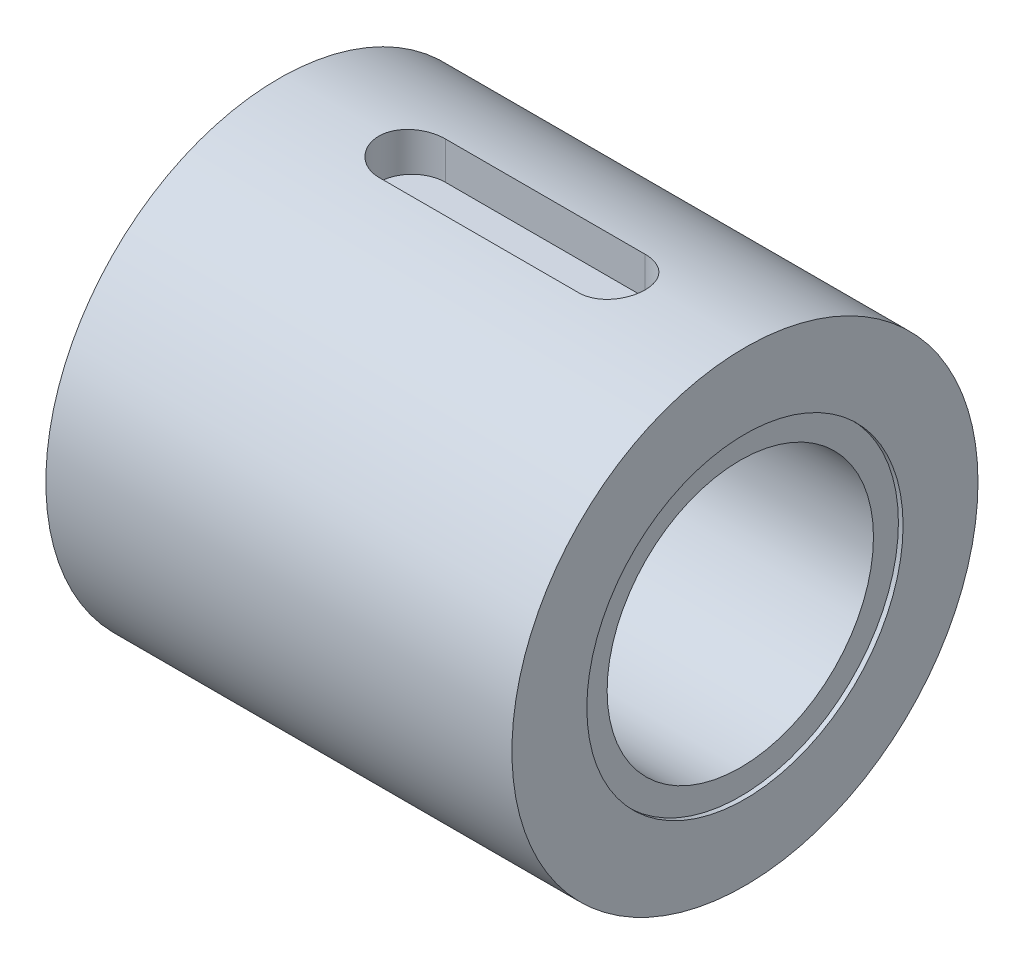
SolidWorks part; units mm, degrees
ref_plane "Front" through (0, 0, 0) normal (0, 0, 1) x (1, 0, 0)
ref_plane "Top" through (0, 0, 0) normal (0, 1, 0) x (1, 0, 0)
ref_plane "Right" through (0, 0, 0) normal (1, 0, 0) x (0, 0, -1)
sketch "Sketch1" plane through (0, 0, 0) normal (1, 0, 0) x (0, 0, -1)
  circle A0 centre (0, 0) radius 7
  circle A1 centre (0, 0) radius 4
extrude "Extrude1" add sketch "Sketch1" along normal blind 14
sketch "Sketch2" plane through (14, 0, 0) normal (1, 0, 0) x (0, 0, -1)
  circle A0 centre (0, 0) radius 4
  circle A1 centre (0, 0) radius 4.7495
extrude "Cut-Extrude1" cut sketch "Sketch2" against normal blind 0.14
sketch "Sketch3" plane through (0, 0, 0) normal (-1, 0, 0) x (0, 0, 1)
  circle A1 centre (0, 0) radius 4.7495
  circle A2 centre (0, 0) radius 4.7495
  circle A3 centre (0, 0) radius 4
  circle A4 centre (0, 0) radius 4
  dimension "D1" = 0
  dimension "D2" = 0
extrude "Cut-Extrude2" cut sketch "Sketch3" against normal blind 0.14
ref_plane "Plane1" through (0, 7, 0) normal (0, 1, 0) x (-1, 0, 0)
sketch "Sketch4" plane through (0, 7, 0) normal (0, 1, 0) x (-1, 0, 0)
  line L0 (0, 0) -> (-14, 0) construction
  line L2 (-10, -1) -> (-4, -1)
  line L3 (-4, 1) -> (-10, 1)
  line L4 (-7, 1) -> (-7, -1) construction
  arc A0 (-4, -1) -> (-4, 1) centre (-4, 0) ccw
  arc A1 (-10, 1) -> (-10, -1) centre (-10, 0) ccw
  point P2 (0, 0)
  point P13 (-7, 0)
extrude "Cut-Extrude3" cut sketch "Sketch4" against normal blind 1.2
sketch "Sketch5" plane through (0, 0, 0) normal (0, 1, 0) x (1, 0, 0)
  line L0 (0, 0) -> (14, 0) construction
  line L1 (14, -7) -> (14, 7) construction
  circle A0 centre (12.5, 0) radius 0.75
extrude "Cut-Extrude4" [suppressed] cut sketch "Sketch5" along normal through all
sketch "Sketch6" plane through (0, 0, 0) normal (0, 0, 1) x (1, 0, 0)
  line L0 (0, 0) -> (5.6719, 0) construction
  line L1 (0, 8.1) -> (0.9, 9)
  line L2 (0, 7) -> (0, -7) construction
  line L3 (0.9, 9) -> (6.3, 9)
  line L4 (6.3, 9) -> (7.2, 8.1)
  line L5 (7.2, 8.1) -> (9, 8.1)
  line L6 (9, 8.1) -> (9, 7)
  line L8 (9, 7) -> (0, 7)
  line L9 (0, 7) -> (0, 8.1)
revolve "Cut-Revolve1" [suppressed] cut sketch "Sketch6" angle 360 about L0
ref_plane "Plane2" through (0, 0, -7) normal (0, 0, 1) x (1, 0, 0)
sketch "Sketch7" plane through (0, 0, -7) normal (0, 0, 1) x (1, 0, 0)
  line L0 (0, 0) -> (14, 0) construction
  line L1 (14, -7) -> (14, 7) construction
  circle A0 centre (12.5, 0) radius 1.5
extrude "Cut-Extrude5" [suppressed] cut sketch "Sketch7" along normal blind 2
sketch "Sketch8" plane through (0, 0, 0) normal (-1, 0, 0) x (0, 0, 1)
  line L0 (-10.2835, 9.5) -> (10.2835, 9.5)
  line L1 (-10.2835, -9.5) -> (10.2835, -9.5)
  line L2 (0, 9.5) -> (0, -9.5) construction
  arc A0 (-10.2835, 9.5) -> (-10.2835, -9.5) centre (0, 0) ccw
  arc A1 (10.2835, -9.5) -> (10.2835, 9.5) centre (0, 0) ccw
  circle A2 centre (0, 0) radius 4.7495
extrude "Extrude2" [suppressed] add sketch "Sketch8" against normal blind 6
sketch "Sketch10" [suppressed] plane through (10, 0, 0) normal (1, 0, 0) x (0, 0, -1)
  circle A0 centre (0, 0) radius 21.25
  circle A1 centre (0, 0) radius 21.5
extrude "Extrude3" [suppressed] add sketch "Sketch10" along normal blind 4
sketch "Sketch11" plane through (0, 0, 0) normal (-1, 0, 0) x (0, 0, 1)
  line L0 (0, 0) -> (-9.5263, 5.5) construction
  line L1 (0, 0) -> (-11, 0) construction
  line L2 (0, 0) -> (0, 6.5603) construction
  circle A0 centre (0, 0) radius 11 construction
  circle A1 centre (-9.5263, 5.5) radius 1.7
  circle A2 centre (-9.5263, -5.5) radius 1.7
  circle A3 centre (9.5263, -5.5) radius 1.7
  circle A4 centre (9.5263, 5.5) radius 1.7
  dimension "D1" = 30
  dimension "E" = 22
  dimension "F" = 3.4
extrude "Cut-4_HOLE" [suppressed] cut sketch "Sketch11" against normal through all
sketch "Sketch12" plane through (0, 0, 0) normal (-1, 0, 0) x (0, 0, 1)
  line L0 (0, 0) -> (-11, 0) construction
  line L1 (0, 0) -> (-7.7782, 7.7782) construction
  line L2 (0, 0) -> (0, 6.1908) construction
  circle A0 centre (0, 0) radius 11 construction
  circle A1 centre (-7.7782, 7.7782) radius 1.7
  circle A2 centre (-11, 0) radius 1.7
  circle A3 centre (-7.7782, -7.7782) radius 1.7
  circle A4 centre (7.7782, -7.7782) radius 1.7
  circle A5 centre (11, 0) radius 1.7
  circle A6 centre (7.7782, 7.7782) radius 1.7
  dimension "D1" = 22
  dimension "F" = 3.4
  dimension "D2" = 45
extrude "Cut-6_HOLE" [suppressed] cut sketch "Sketch12" against normal through all
sketch "Sketch13" plane through (0.14, 0, 0) normal (-1, 0, 0) x (0, 0, 1)
  circle A0 centre (0, 0) radius 16.75
  circle A1 centre (0, 0) radius 8
  dimension "D1" = 33.5
extrude "Extrude5" [suppressed] add sketch "Sketch13" along normal blind 10.36
ref_plane "Plane3" through (0, 0, 0) normal (0, 0, 1) x (1, 0, 0)
sketch "Sketch14" plane through (0, 0, 0) normal (0, 0, 1) x (1, 0, 0)
  line L0 (0, 0) -> (8.7729, 0) construction
  circle A0 centre (3, 0) radius 2
extrude "Cut-Extrude6" [suppressed] cut sketch "Sketch14" along normal through all
equation "\"D1@Sketch2\" = \"C@Sketch1\"*.6785"
equation "\"D2@Sketch2\" = \"ID@Sketch1\""
equation "\"D1@Cut-Extrude1\" = \"H@Extrude1\"*.01"
equation "\"D1@Cut-Extrude2\" = \"H@Extrude1\"*.01"
equation "\"D1@Plane1\" = \"C@Sketch1\"/2"
equation "\"D1@Sketch5\" = \"F@Sketch4\"*.75"
equation "\"D2@Sketch5\" = (\"H@Extrude1\"-\"E@Sketch4\")/4"
equation "\"D3@Sketch6\" = \"K@Sketch6\"*.6"
equation "\"D4@Sketch6\" = \"D@Sketch6\"*.9"
equation "\"D1@Plane2\" = \"C@Sketch1\"/2"
equation "\"D1@Sketch7\" = (\"H@Extrude1\"-\"E@Sketch4\")/4"
equation "\"D5@Sketch6\" = \"C@Sketch1\""
equation "\"D3@Sketch8\" = \"D1@Sketch2\""
equation "\"D2@Sketch10\" = \"C@Sketch1\""
equation "\"D2@Sketch14\" = \"K@Extrude2\"/2"
